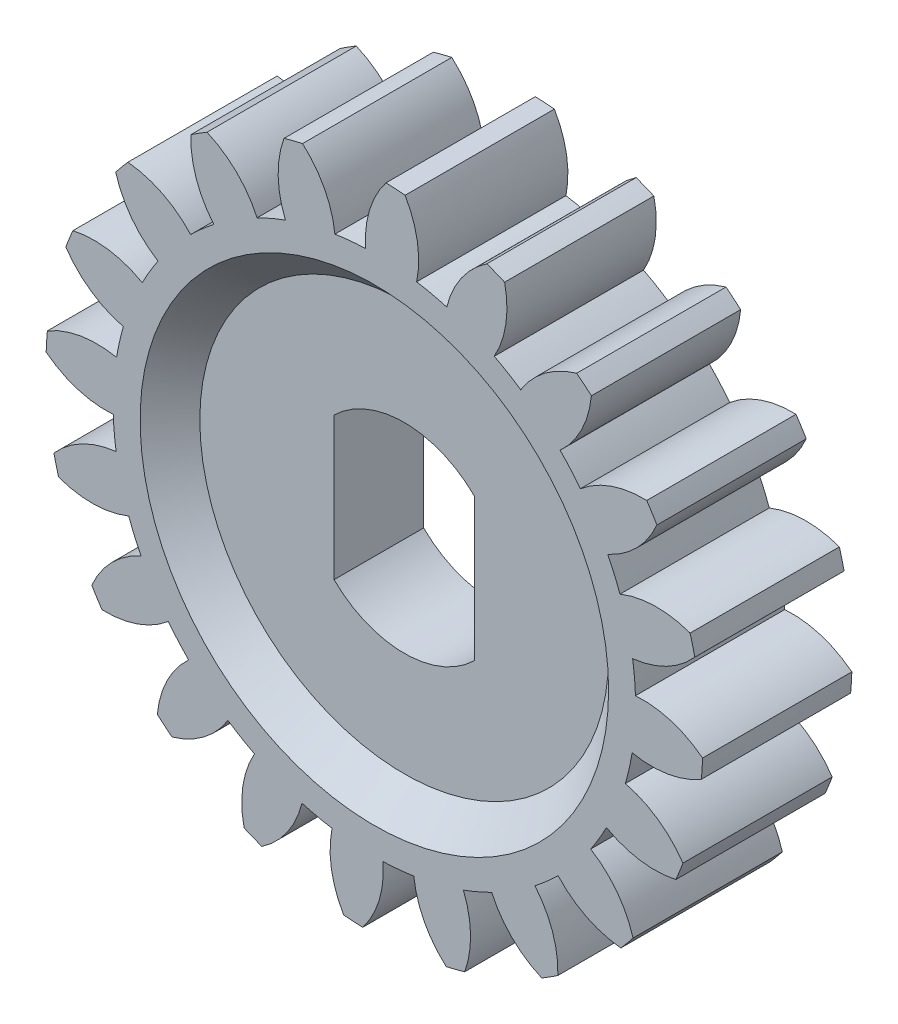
SolidWorks part; units mm, degrees
ref_plane "Front Plane" through (0, 0, 0) normal (0, 0, 1) x (1, 0, 0)
ref_plane "Top Plane" through (0, 0, 0) normal (0, 1, 0) x (1, 0, 0)
ref_plane "Right Plane" through (0, 0, 0) normal (1, 0, 0) x (0, 0, -1)
sketch "Root Circle" plane through (0, 0, 0) normal (0, 0, 1) x (1, 0, 0)
  circle A0 centre (0, 0) radius 8.75
extrude "Root Circle Thickness" add sketch "Root Circle" along normal blind 5
sketch "Sketch3" plane through (0, 0, 5) normal (0, 0, 1) x (1, 0, 0)
  line L0 (0, 0) -> (8.75, 0) construction
  line L1 (8.75, 0) -> (10.8889, 0) construction
  line L2 (0, 0) -> (8.8302, 3.2139) construction
  line L3 (8.8302, 3.2139) -> (10, 0) construction
  line L4 (10.3545, 0) -> (8.5279, -3.9468) construction
  line L5 (9.999, 0.1399) -> (9.9792, -0.6453) construction
  line L6 (0, 0) -> (9.9792, -0.6453) construction
  circle A0 centre (0, 0) radius 9.3969 construction
  circle A1 centre (0, 0) radius 10 construction
  arc A2 (10.9518, -1.0289) -> (10.9931, -0.3901) centre (0, 0) ccw
  circle A3 centre (0, 0) radius 8.75 construction
  arc A4 (10.9931, -0.3901) -> (8.7451, 0.2929) centre (8.9845, -2.9601) ccw
  arc A5 (8.6346, -1.4166) -> (8.7451, 0.2929) centre (0, 0) ccw
  arc A6 (10.9518, -1.0289) -> (8.6346, -1.4166) centre (9.2909, 1.7784) cw
  point P10 (10.3545, 0)
  point P15 (8.9845, -2.9601)
extrude "Extrude3" add sketch "Sketch3" against normal blind 5
pattern_circular "CirPattern1" count 20 over 360 about axis through (0, 0, 0) along (0, 0, 1) of "Extrude3", "Root Circle Thickness"
sketch "Sketch4" plane through (0, 0, 5) normal (0, 0, 1) x (1, 0, 0)
  line L0 (2.35, 2.3875) -> (2.35, -2.3875)
  line L1 (-2.35, 2.3875) -> (-2.35, -2.3875)
  arc A0 (-2.35, -2.3875) -> (2.35, -2.3875) centre (0, 0) ccw
  arc A1 (2.35, 2.3875) -> (-2.35, 2.3875) centre (0, 0) ccw
  dimension "D1" = 6.7
  dimension "D2" = 2.35
  dimension "D3" = 2.35
extrude "Extrude4" cut sketch "Sketch4" against normal through all
sketch "Sketch5" plane through (0, 0, 5) normal (0, 0, 1) x (1, 0, 0)
  circle A0 centre (0, 0) radius 6.8462
extrude "Extrude5" cut sketch "Sketch5" against normal blind 1
ref_plane "Plane1" through (0, 0, 2.5) normal (0, 0, 1) x (1, 0, 0)
mirror "Mirror1" about plane through (0, 0, 2.5) normal (0, 0, 1) of "Extrude5"
chamfer "Chamfer1" distance 1 angle 45 2 edges at (6.8462, 0, 0) (6.8462, 0, 5)
equation "\"m\"=1"
equation "\"t\"=20"
equation "\"phi\"=20 ' Pressure Angle"
equation "\"a\"=\"m\" ' Addendum"
equation "\"d\"=1.25*\"a\" ' Dedendum"
equation "\"PCD\"=\"m\"*\"t\" ' Pitch Circle Diameter"
equation "\"TCD\"=\"PCD\"+(2*\"a\") ' Tip Circle Diameter"
equation "\"BCD\"=\"PCD\"* cos( \"phi\")  ' Base Circle Diameter"
equation "\"RCD\"=\"PCD\"-(2*\"d\") ' Root Circle Diameter"
equation "\"P\"= pi *\"m\" ' Circular Pitch"
equation "\"PA\"=360/\"t\" ' Pitch Angle"
equation "\"CTT\"=(pi*\"m\")/4"
equation "\"FR\"=0.3/\"P\" ' Fillet Radius"
equation "\"PC\"=(\"TCD\"-\"BCD\")/6 ' Point C Distance"
equation "\"DpD\"= \"D1@Sketch3\""
equation "\"D2@Sketch3\" = \"DpD\"/4"
